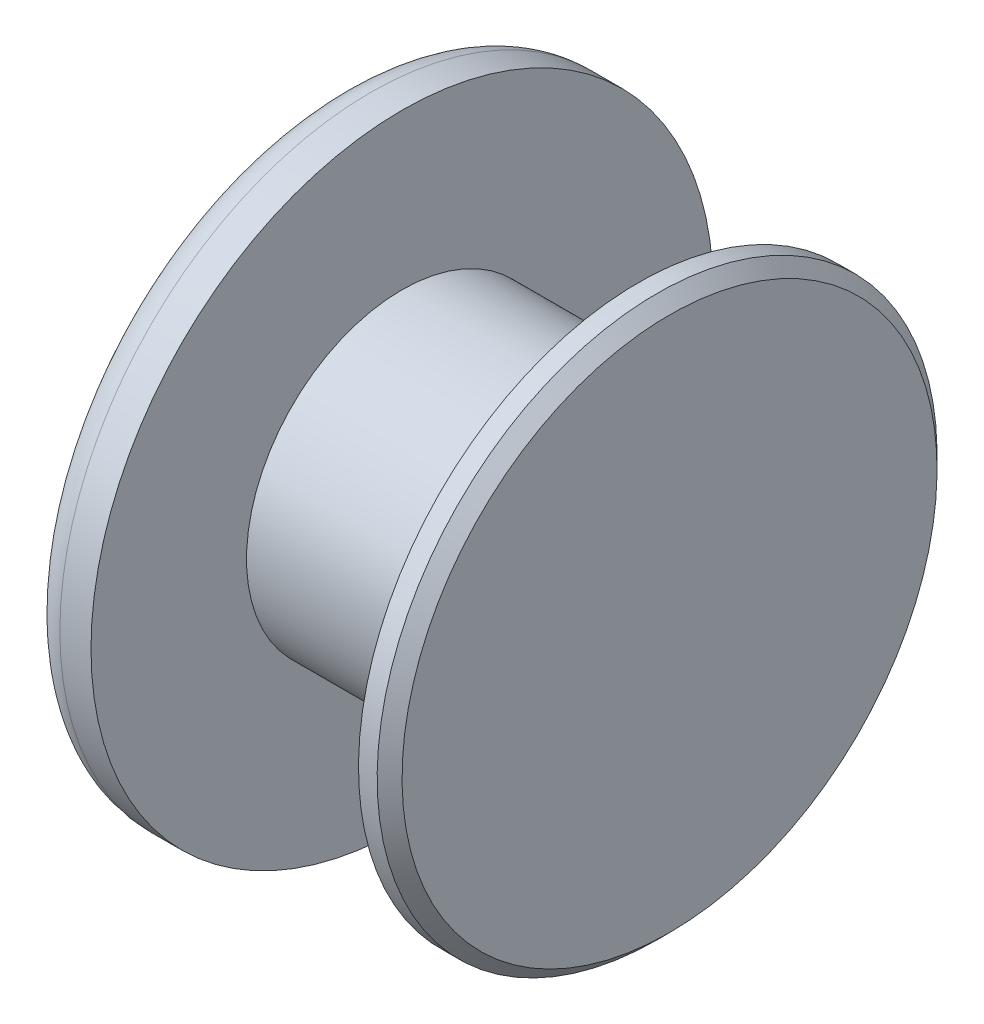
SolidWorks part; units mm, degrees
ref_plane "Plan de face" through (0, 0, 0) normal (0, 0, 1) x (1, 0, 0)
ref_plane "Plan de dessus" through (0, 0, 0) normal (0, 1, 0) x (1, 0, 0)
ref_plane "Plan de droite" through (0, 0, 0) normal (1, 0, 0) x (0, 0, -1)
sketch "Esquisse1" plane through (0, 0, 0) normal (0, 0, 1) x (1, 0, 0)
  line L0 (-2.65, 0) -> (2.65, 0) construction
  line L1 (-2.65, 0) -> (-2.65, 5)
  line L2 (-2.65, 5) -> (-1.65, 5)
  line L3 (-1.65, 5) -> (-1.65, 2.5)
  line L4 (-1.65, 2.5) -> (2.15, 2.5)
  line L5 (2.15, 2.5) -> (2.15, 4.5)
  line L6 (2.15, 4.5) -> (2.65, 4.5)
  line L7 (2.65, 4.5) -> (2.65, 0)
  line L8 (2.65, 0) -> (-2.65, 0)
  point P4 (0, 0)
  dimension "D1" = 5.3
  dimension "D2" = 1
  dimension "D3" = 0.5
  dimension "D4" = 2.5
  dimension "D5" = 4.5
  dimension "D6" = 5
revolve "Révolution1" add sketch "Esquisse1" angle 360 about L0
fillet "Congé1" radius 0.5 1 edges at (-2.65, -5, 0)
chamfer "Chanfrein1" distance 0.2 angle 45 1 edges at (2.65, -4.5, 0)
